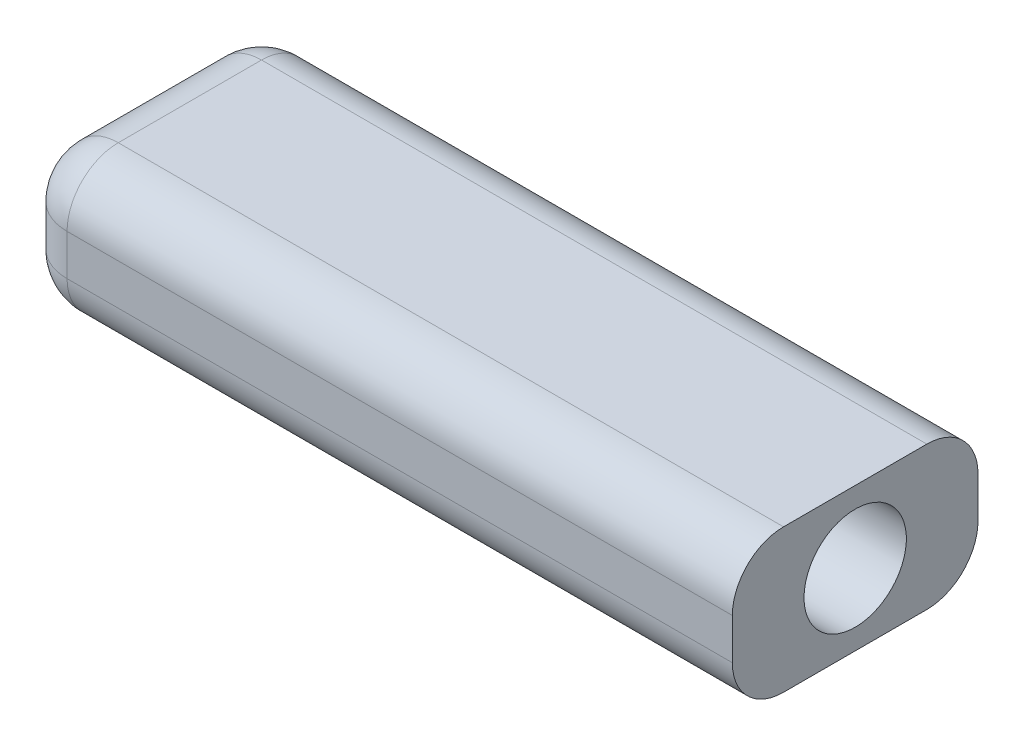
SolidWorks part; units mm, degrees
ref_plane "Front" through (0, 0, 0) normal (0, 0, 1) x (1, 0, 0)
ref_plane "Top" through (0, 0, 0) normal (0, 1, 0) x (1, 0, 0)
ref_plane "Right" through (0, 0, 0) normal (1, 0, 0) x (0, 0, -1)
sketch "Sketch2" plane through (0, 0, 0) normal (0, 1, 0) x (1, 0, 0)
  line L1 (-35, 12) -> (35, 12)
  line L2 (-35, 12) -> (-35, -12)
  line L3 (-35, -12) -> (35, -12)
  line L4 (35, 12) -> (35, -12)
  line L5 (-35, 12) -> (35, -12) construction
  line L6 (-35, -12) -> (35, 12) construction
  point P0 (0, 0)
  dimension "D1" = 70
  dimension "D2" = 24
extrude "Boss-Extrude1" add sketch "Sketch2" along normal blind 14
fillet "Fillet1" radius 5 8 edges at (0, 0, -12) (0, 14, -12) (0, 0, 12) (0, 14, 12) (-35, 7, -12) (-35, 14, 0) (-35, 7, 12) (-35, 0, 0)
sketch "Sketch3" plane through (35, 0, 0) normal (-1, 0, 0) x (0, 0, 1)
  line L0 (12, 9) -> (12, 5) construction
  circle A0 centre (0, 7) radius 5
  point P7 (12, 7)
  dimension "D1" = 10
extrude "Cut-Extrude1" cut sketch "Sketch3" along normal blind 55
